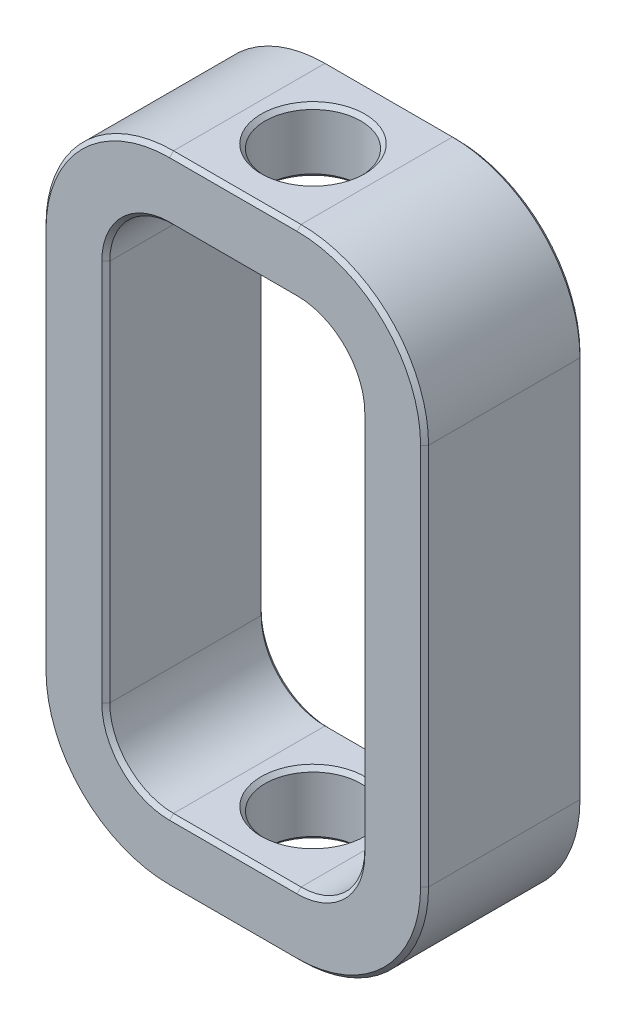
SolidWorks part; units mm, degrees
ref_plane "Спереди" through (0, 0, 0) normal (0, 0, 1) x (1, 0, 0)
ref_plane "Сверху" through (0, 0, 0) normal (0, 1, 0) x (1, 0, 0)
ref_plane "Справа" through (0, 0, 0) normal (1, 0, 0) x (0, 0, -1)
sketch "Эскиз1" plane through (0, 0, 0) normal (0, 0, 1) x (1, 0, 0)
  line L0 (-8, 12) -> (-8, -12)
  line L1 (4, 20) -> (-4, 20)
  line L2 (12, 12) -> (12, -12)
  line L3 (4, -20) -> (-4, -20)
  line L4 (-12, 12) -> (-12, -12)
  line L5 (12, 20) -> (-12, -20) construction
  line L6 (12, -20) -> (-12, 20) construction
  line L7 (4, -16) -> (-4, -16)
  line L8 (8, 12) -> (8, -12)
  line L9 (4, 16) -> (-4, 16)
  arc A0 (-4, -20) -> (-12, -12) centre (-4, -12) cw
  arc A1 (12, -12) -> (4, -20) centre (4, -12) cw
  arc A2 (4, 20) -> (12, 12) centre (4, 12) cw
  arc A3 (-4, 20) -> (-12, 12) centre (-4, 12) ccw
  arc A4 (-4, 16) -> (-8, 12) centre (-4, 12) ccw
  arc A5 (-4, -16) -> (-8, -12) centre (-4, -12) cw
  arc A6 (8, -12) -> (4, -16) centre (4, -12) cw
  arc A7 (4, 16) -> (8, 12) centre (4, 12) cw
  point P0 (0, 0)
  dimension "D3" = 8
  dimension "D1" = 24
  dimension "D2" = 40
  dimension "D4" = 4
extrude "Бобышка-Вытянуть1" add sketch "Эскиз1" along normal blind 10
sketch "Эскиз2" plane through (0, 0, 0) normal (0, 1, 0) x (1, 0, 0)
  circle A0 centre (0, -5) radius 3
  dimension "D1" = 6
  dimension "D2" = 5
extrude "Вырез-Вытянуть1" cut sketch "Эскиз2" against normal mid plane 40
chamfer "Фаска1" distance 0.25 angle 45 36 edges at (6.8284, 14.8284, 0) (8, 0, 0) (6.8284, -14.8284, 0) (0, -16, 0) (-6.8284, -14.8284, 0) (-8, 0, 0) (-6.8284, 14.8284, 0) (0, 16, 0) (0, -20, 0) (9.6569, -17.6569, 0) (12, 0, 0) (9.6569, 17.6569, 0) (0, 20, 0) (-9.6569, 17.6569, 0) (-12, 0, 0) (-9.6569, -17.6569, 0) (0, 20, 8) (0, 16, 2) (0, -20, 8) (0, -16, 8) (-8, 0, 10) (-6.8284, -14.8284, 10) (0, -16, 10) (6.8284, -14.8284, 10) (8, 0, 10) (6.8284, 14.8284, 10) (0, 16, 10) (-6.8284, 14.8284, 10) (-12, 0, 10) (-9.6569, 17.6569, 10) (0, 20, 10) (9.6569, 17.6569, 10) (12, 0, 10) (9.6569, -17.6569, 10) (0, -20, 10) (-9.6569, -17.6569, 10)
